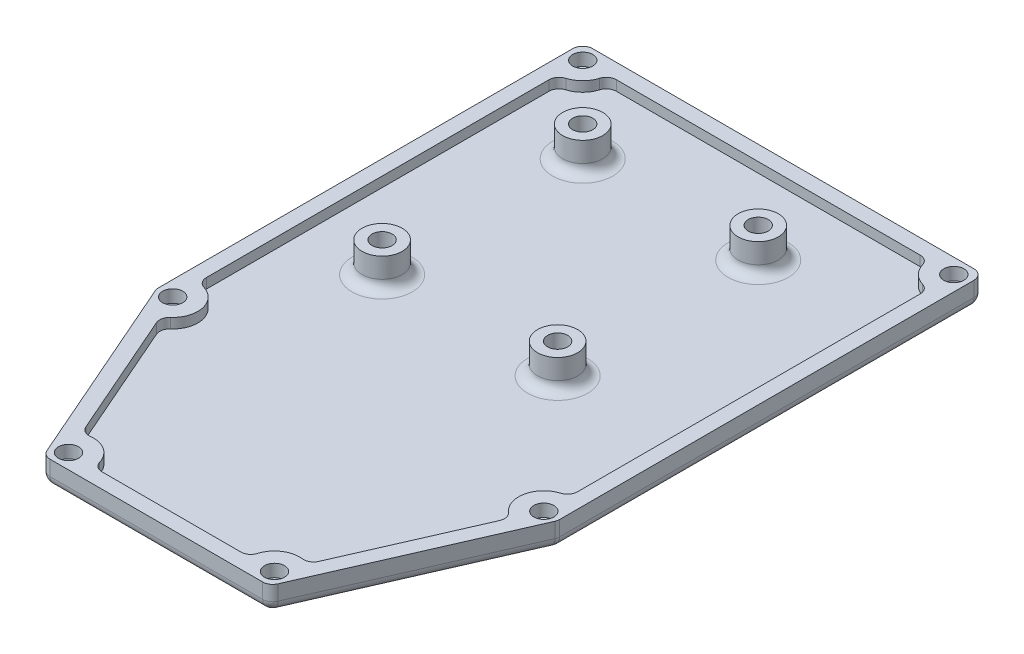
SolidWorks part; units mm, degrees
ref_plane "Front Plane" through (0, 0, 0) normal (0, 0, 1) x (1, 0, 0)
ref_plane "Top Plane" through (0, 0, 0) normal (0, 1, 0) x (1, 0, 0)
ref_plane "Right Plane" through (0, 0, 0) normal (1, 0, 0) x (0, 0, -1)
sketch "Sketch1" plane through (0, 0, 0) normal (0, 1, 0) x (1, 0, 0)
  line L0 (-45.9688, 40.0312) -> (34.0312, 40.0312)
  line L1 (34.0312, 40.0312) -> (34.0313, -44.9688)
  line L2 (-45.9688, 40.0312) -> (-45.9687, -44.9688)
  line L3 (-28.4687, -84.9688) -> (16.5313, -84.9688)
  line L4 (16.5313, -84.9688) -> (34.0313, -44.9688)
  line L5 (-28.4687, -84.9688) -> (-45.9687, -44.9688)
  dimension "D1" = 80
  dimension "D2" = 85
  dimension "D3" = 85
  dimension "D4" = 45
  dimension "D5" = 17.5
  dimension "D6" = 125
extrude "Boss-Extrude1" add sketch "Sketch1" along normal blind 5
sketch "Sketch2" plane through (0, 5, 0) normal (0, 1, 0) x (1, 0, 0)
  line L0 (34.0312, 40.0312) -> (-45.9688, 40.0312) construction
  line L1 (-45.9687, -44.9688) -> (-28.4687, -84.9688) construction
  line L2 (34.0313, -44.9688) -> (34.0312, 40.0312) construction
  line L3 (-45.9688, 40.0312) -> (-45.9687, -44.9688) construction
  line L4 (-28.4687, -84.9688) -> (16.5313, -84.9688) construction
  point P0 (-42.9688, 37.0312)
  point P1 (31.0313, 37.0312)
  point P2 (31.0313, -44.7188)
  point P3 (14.5733, -81.9688)
  point P4 (-26.5067, -81.9688)
  point P5 (-42.9688, -44.7188)
  dimension "D1" = 3
  dimension "D2" = 3
  dimension "D3" = 3
  dimension "D4" = 41.08
  dimension "D5" = 81.75
  dimension "D6" = 3
  dimension "D8" = 3
hole_wizard "CBORE for M5 Hex Head Bolt7" positions "Sketch3" profile "Sketch4" counterbore size "M5" standard "ANSI Metric"
sketch "Sketch3" plane through (0, 5, 0) normal (0, 1, 0) x (1, 0, 0)
  point P0 (-42.9688, 37.0312)
  point P3 (31.0313, 37.0312)
  point P6 (31.0313, -44.7188)
  point P9 (14.5733, -81.9688)
  point P12 (-26.5067, -81.9688)
  point P15 (-42.9688, -44.7188)
sketch "Sketch4" plane through (-42.9688, 5, -37.0312) normal (1, 0, 0) x (0, 0, 1)
  line L0 (0, 0) -> (0, 5)
  line L1 (0, 5) -> (1.1, 5)
  line L3 (1.1, 5) -> (1.1, 2.5)
  line L4 (1.1, 2.5) -> (2, 2.5)
  line L5 (2, 2.5) -> (2, 0)
  line L7 (2, 0) -> (0, 0)
  line L11 (0, -6.35) -> (0, 107.95) construction
  dimension "Thru Hole Dia." = 2.2
  dimension "Thru Hole Depth" = 5
  dimension "C'Bore Dia." = 4
  dimension "C'Bore Depth" = 2.5
fillet "Fillet1" radius 2 6 edges at (-45.9687, 0, 2.4688) (-37.2187, 0, 64.9688) (-5.9687, 0, 84.9688) (25.2813, 0, 64.9688) (34.0313, 0, 2.4688) (-5.9688, 0, -40.0312)
fillet "Fillet2" radius 2 12 edges at (-45.383, 0.5858, -39.4455) (-28.0856, 0.5858, 84.383) (-45.4144, 0.6179, 44.8528) (-45.9688, 3.5, -40.0312) (-28.4687, 3.5, 84.9688) (-45.9687, 3.5, 44.9688) (16.1481, 0.5858, 84.383) (33.4769, 0.6179, 44.8528) (33.4455, 0.5858, -39.4455) (16.5313, 3.5, 84.9688) (34.0313, 3.5, 44.9688) (34.0312, 3.5, -40.0312)
shell "Shell1" thickness 3
fillet "Fillet3" radius 2 12 edges at (-40.8269, 4, 49.2368) (-42.9687, 4, 39.7188) (-42.9688, 4, -32.0312) (31.0313, 4, 39.7188) (28.8894, 4, 49.2368) (31.0312, 4, -32.0312) (9.5733, 4, 81.9688) (16.574, 4, 77.3865) (-21.5067, 4, 81.9688) (-28.5108, 4, 77.388) (-37.9687, 4, -37.0312) (26.0313, 4, -37.0312)
sketch "Sketch7" plane through (0, 3, 0) normal (0, 1, 0) x (1, 0, 0)
  line L0 (24.323, 37.0312) -> (-36.2605, 37.0312) construction
  line L1 (-42.9687, -38.0105) -> (-42.9688, 30.323) construction
  circle A0 centre (-27.9687, 22.0312) radius 2
  circle A1 centre (-27.9687, 22.0312) radius 4
  circle A2 centre (7.0313, 22.0312) radius 2
  circle A3 centre (7.0313, 22.0312) radius 4
  circle A4 centre (-27.9687, -17.9688) radius 2
  circle A5 centre (-27.9687, -17.9688) radius 4
  circle A6 centre (7.0313, -17.9688) radius 2
  circle A7 centre (7.0313, -17.9688) radius 4
  dimension "D1" = 35
  dimension "D6" = 4
  dimension "D7" = 8
  dimension "D8" = 8
  dimension "D9" = 4
  dimension "D10" = 4
  dimension "D11" = 8
  dimension "D12" = 4
  dimension "D13" = 8
  dimension "D2" = 40
  dimension "D3" = 15
  dimension "D4" = 40
  dimension "D5" = 35
  dimension "D14" = 15
extrude "Boss-Extrude2" add sketch "Sketch7" along normal blind 6
fillet "Fillet4" radius 2 4 edges at (7.0313, 3, 21.9688) (-27.9687, 3, -18.0312) (7.0313, 3, -18.0312) (-27.9687, 3, 21.9688)
